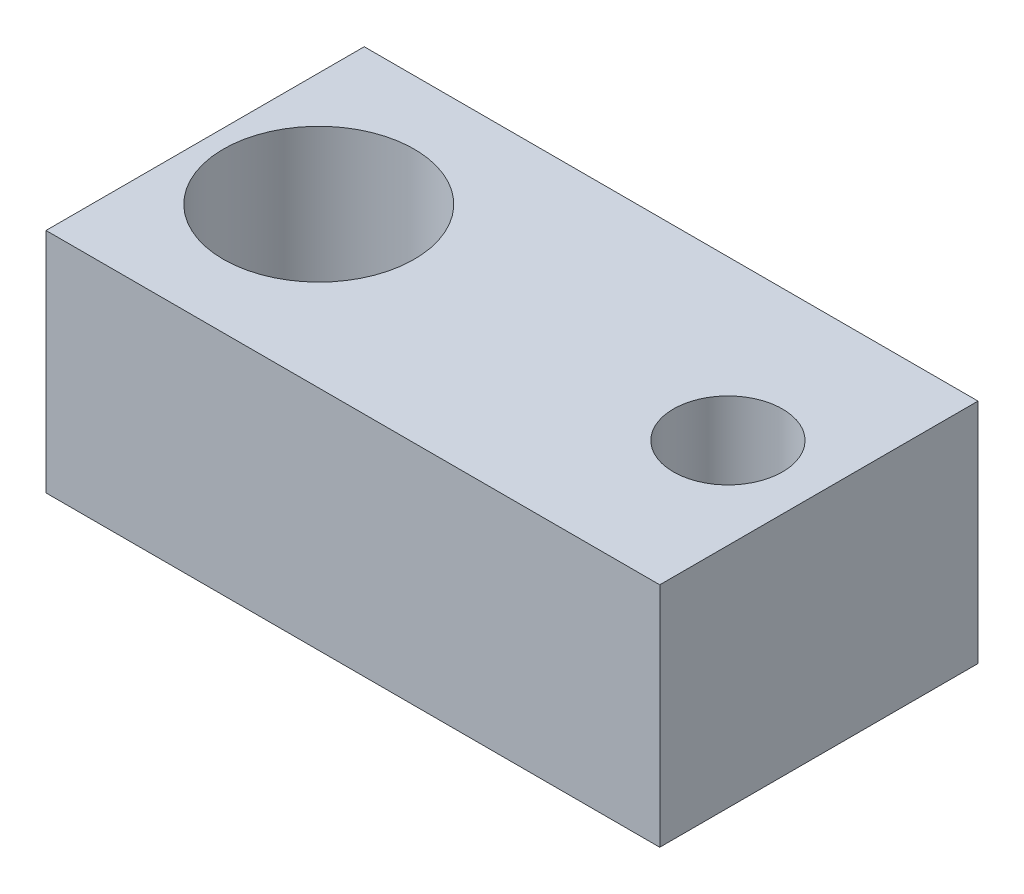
SolidWorks part; units mm, degrees
ref_plane "Face" through (0, 0, 0) normal (0, 0, 1) x (1, 0, 0)
ref_plane "Dessus" through (0, 0, 0) normal (0, 1, 0) x (1, 0, 0)
ref_plane "Droite" through (0, 0, 0) normal (1, 0, 0) x (0, 0, -1)
sketch "Esquisse1" plane through (0, 0, 0) normal (0, 0, 1) x (1, 0, 0)
  line L1 (0, 0) -> (135, 0)
  line L2 (0, 0) -> (0, 50)
  line L3 (0, 50) -> (135, 50)
  line L4 (135, 0) -> (135, 50)
  dimension "D1" = 135
  dimension "D2" = 50
extrude "Base-Extrusion" add sketch "Esquisse1" along normal blind 70
sketch "Esquisse2" plane through (0, 50, 0) normal (0, 1, 0) x (-1, 0, 0)
  line L0 (-25, 0) -> (-25, 70) construction
  line L1 (-135, 0) -> (0, 0) construction
  line L3 (-135, 70) -> (-135, 0) construction
  line L4 (-135, 70) -> (0, 70) construction
  circle A0 centre (-25, 35) radius 21
  dimension "D2" = 42
  dimension "D1" = 110
extrude "Enlèv. mat.-Extru.1" cut sketch "Esquisse2" against normal through all
sketch "Esquisse3" plane through (0, 50, 0) normal (0, 1, 0) x (-1, 0, 0)
  line L0 (-115, 0) -> (-115, 70) construction
  line L1 (-135, 0) -> (0, 0) construction
  line L2 (-135, 70) -> (0, 70) construction
  circle A0 centre (-25, 35) radius 21 construction
  circle A1 centre (-115, 35) radius 12
  dimension "D1" = 90
  dimension "D2" = 24
extrude "Enlèv. mat.-Extru.2" cut sketch "Esquisse3" against normal through all
